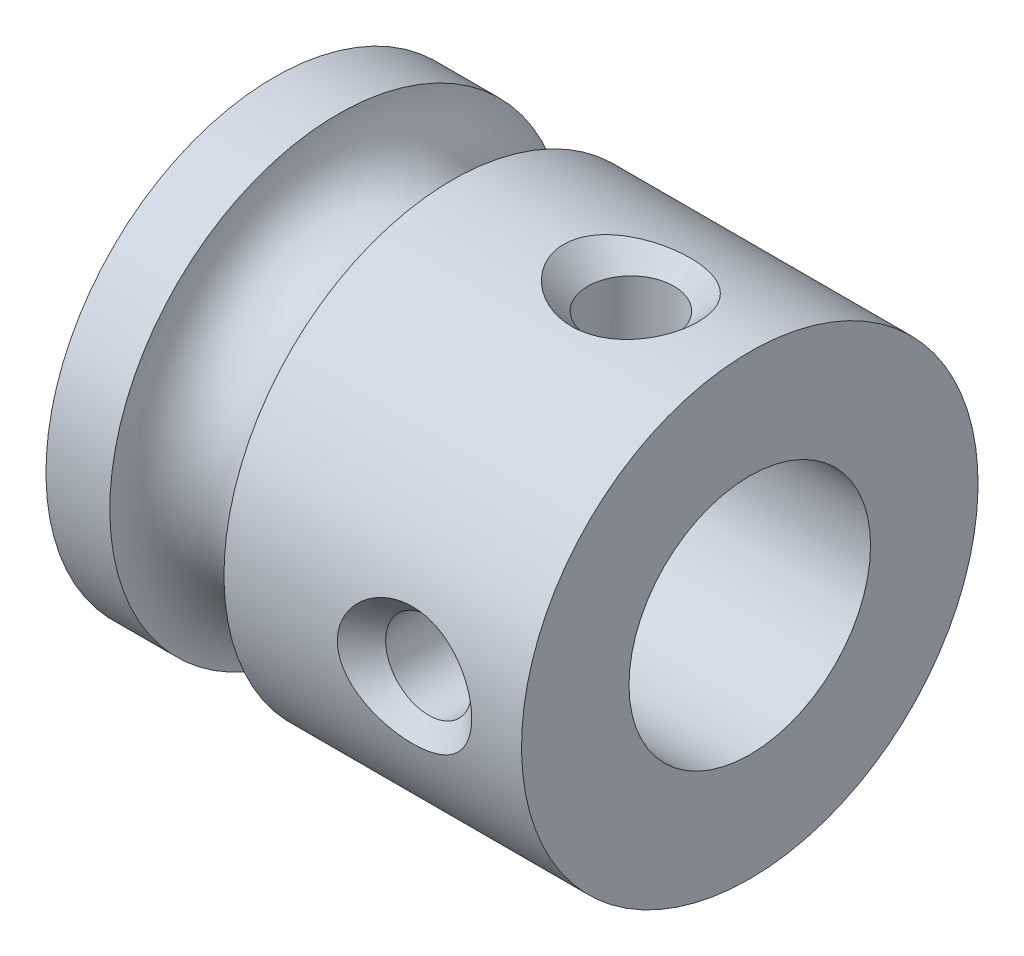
SolidWorks part; units mm, degrees
ref_plane "Front Plane" through (0, 0, 0) normal (0, 0, 1) x (1, 0, 0)
ref_plane "Top Plane" through (0, 0, 0) normal (0, 1, 0) x (1, 0, 0)
ref_plane "Right Plane" through (0, 0, 0) normal (1, 0, 0) x (0, 0, -1)
sketch "Sketch1" plane through (0, 0, 0) normal (0, 0, 1) x (1, 0, 0)
  line L0 (-27.9822, 0) -> (27.9822, 0) construction
  line L1 (-6.25, 6) -> (-4.5715, 6)
  line L2 (-6.25, 6) -> (-6.25, 0)
  line L3 (6.25, 6) -> (6.25, 0)
  line L4 (-6.25, 0) -> (6.25, 0)
  line L5 (6.25, 6) -> (-1.5715, 6)
  arc A0 (-4.5715, 6) -> (-1.5715, 6) centre (-3.0715, 6) ccw
  point P3 (0, 0)
  dimension "D1" = 1.5
  dimension "D2" = 12.5
  dimension "D3" = 6
revolve "Revolve1" add sketch "Sketch1" angle 360 about L0
hole_wizard "1/4 (0.25) Diameter Hole1" positions "Sketch3" profile "Sketch2" hole size "1/4" standard "Ansi Inch"
sketch "Sketch3" plane through (6.25, 0, 0) normal (1, 0, 0) x (0, 0, -1)
  point P0 (0, 0)
sketch "Sketch2" plane through (6.25, 0, 0) normal (0, 1, 0) x (0, 0, -1)
  line L0 (0, 0) -> (0, 12.5)
  line L1 (0, 12.5) -> (3.175, 12.5)
  line L2 (3.175, 12.5) -> (3.175, 0)
  line L5 (3.175, 0) -> (0, 0)
  line L11 (0, -6.35) -> (0, 107.95) construction
  dimension "Thru Hole Dia." = 6.35
  dimension "Thru Hole Depth" = 12.5
hole_wizard "#4-40 Tapped Hole3" positions "Sketch10" profile "Sketch9" tap size "#4-40" standard "Ansi Inch"
sketch "Sketch10" plane through (0, 0, 0) normal (0, 1, 0) x (1, 0, 0)
  point P3 (3.125, 0)
sketch "Sketch9" plane through (3.125, 0, 0) normal (1, 0, 0) x (0, 0, -1)
  line L0 (0, 0) -> (0, 6)
  line L1 (0, 6) -> (1.7653, 6)
  line L2 (1.1303, 5.365) -> (1.1303, 0)
  line L5 (1.1303, 0) -> (0, 0)
  line L7 (1.7653, 6) -> (1.1303, 5.365)
  line L8 (-1.7653, 6) -> (-1.1303, 5.365) construction
  line L11 (0, -6.35) -> (0, 107.95) construction
  dimension "Thru Tap Drill Dia." = 2.2606
  dimension "Thru Tap Drill Depth" = 6
  dimension "Far C'Sink Dia." = 3.5306
  dimension "Far C'Sink Angle" = 90
hole_wizard "#4-40 Tapped Hole4" positions "Sketch12" profile "Sketch13" tap size "#4-40" standard "Ansi Inch"
sketch "Sketch12" plane through (0, 0, 0) normal (0, 0, 1) x (1, 0, 0)
  point P1 (3.175, 0)
sketch "Sketch13" plane through (3.175, 0, 0) normal (1, 0, 0) x (0, 1, 0)
  line L0 (0, 0) -> (0, 6)
  line L1 (0, 6) -> (1.7653, 6)
  line L2 (1.1303, 5.365) -> (1.1303, 0)
  line L5 (1.1303, 0) -> (0, 0)
  line L7 (1.7653, 6) -> (1.1303, 5.365)
  line L8 (-1.7653, 6) -> (-1.1303, 5.365) construction
  line L11 (0, -6.35) -> (0, 107.95) construction
  dimension "Thru Tap Drill Dia." = 2.2606
  dimension "Thru Tap Drill Depth" = 6
  dimension "Far C'Sink Dia." = 3.5306
  dimension "Far C'Sink Angle" = 90
